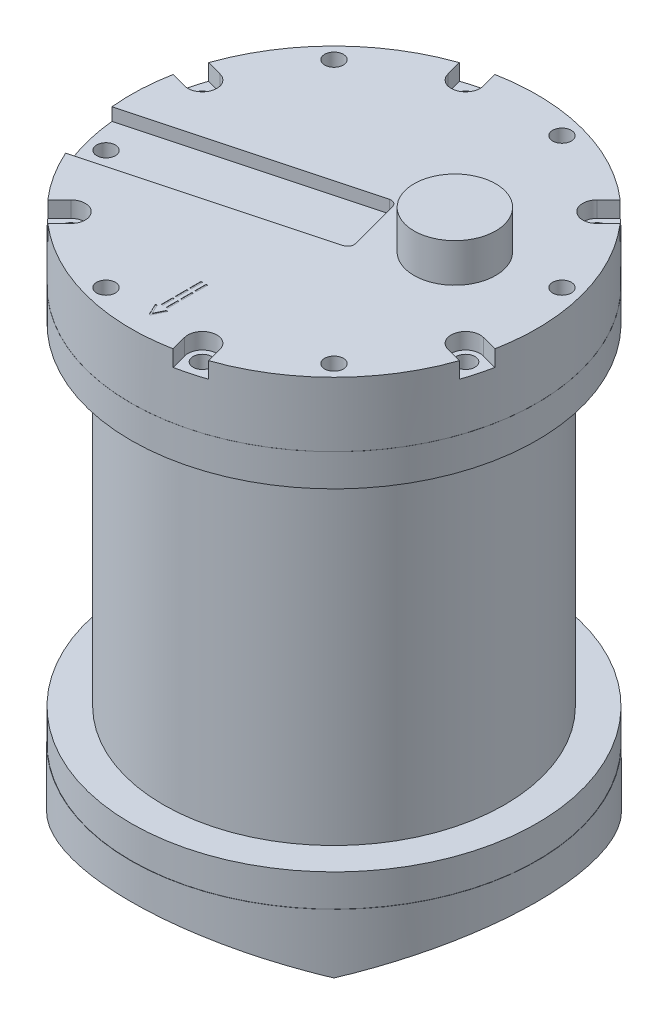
SolidWorks part; units mm, degrees
ref_plane "Front" through (0, 0, 0) normal (0, 0, 1) x (1, 0, 0)
ref_plane "Top" through (0, 0, 0) normal (0, 1, 0) x (1, 0, 0)
ref_plane "Right" through (0, 0, 0) normal (1, 0, 0) x (0, 0, -1)
sketch "Sketch1" plane through (0, 0, 0) normal (0, 1, 0) x (1, 0, 0)
  circle A0 centre (0, 0) radius 63.1
  dimension "D1" = 126.2
extrude "Extrude1" add sketch "Sketch1" along normal blind 31
sketch "Sketch2" plane through (0, 31, 0) normal (0, 1, 0) x (1, 0, 0)
  circle A0 centre (0, 0) radius 63.025
  dimension "D1" = 126.05
extrude "Extrude2" add sketch "Sketch2" along normal blind 10
sketch "Sketch3" plane through (0, 41, 0) normal (0, 1, 0) x (1, 0, 0)
  circle A0 centre (0, 0) radius 53
  dimension "D1" = 106
extrude "Extrude3" add sketch "Sketch3" along normal blind 103
sketch "Sketch4" plane through (0, 0, 0) normal (1, 0, 0) x (0, 0, -1)
  line L0 (4.1912, -3.8007) -> (63.1, 20)
  line L1 (63.1, 31) -> (-63.1, 31) construction
  line L2 (63.1, 0) -> (63.1, 31) construction
  line L4 (0, 31) -> (0, 0) construction
  line L5 (4.1912, -3.8007) -> (72.7161, -3.8007)
  line L6 (72.7161, -3.8007) -> (63.1, 20)
  dimension "D1" = 11
  dimension "D2" = 68
  dimension "D3" = 22
extrude "X-ducer Face" cut sketch "Sketch4" against normal through all and the other way through all
sketch "Sketch18" plane through (0, -4.7231, -1.9082) normal (0, -0.9272, -0.3746) x (1, 0, 0)
  circle A0 centre (0, -38) radius 23.5332
  dimension "D1" = 38
pattern_circular "CirPattern1" count 4 over 360 about axis through (0, 0, 0) along (0, 1, 0)
sketch "Sketch5" plane through (0, 144, 0) normal (0, 1, 0) x (1, 0, 0)
  circle A0 centre (0, 0) radius 63.025
  dimension "D1" = 126.05
extrude "Extrude5" add sketch "Sketch5" along normal blind 10
sketch "Sketch6" plane through (0, 154, 0) normal (0, 1, 0) x (1, 0, 0)
  circle A0 centre (0, 0) radius 63
  dimension "D1" = 126
extrude "Extrude6" add sketch "Sketch6" along normal blind 20
hole_wizard "Ø5.8 (5.8) Diameter Hole1" positions "Sketch9" profile "Sketch8" hole size "Ø5.8" standard "Ansi Metric"
sketch "Sketch9" plane through (0, 174, 0) normal (0, 1, 0) x (-1, 0, 0)
  line L0 (0, 0) -> (0, 88.6387) construction
  line L1 (0, 0) -> (55.8305, 14.9597) construction
  circle A0 centre (0, 0) radius 57.8 construction
  point P0 (55.8305, 14.9597)
  dimension "D1" = 115.6
  dimension "D2" = 75
sketch "Sketch8" plane through (-55.8305, 174, 14.9597) normal (1, 0, 0) x (0, 0, 1)
  line L0 (0, 0) -> (0, 30)
  line L1 (0, 30) -> (2.9, 30)
  line L2 (2.9, 30) -> (2.9, 0)
  line L5 (2.9, 0) -> (0, 0)
  line L11 (0, -6.35) -> (0, 107.95) construction
  dimension "Thru Hole Dia." = 5.8
  dimension "Thru Hole Depth" = 30
pattern_circular "CirPattern2" count 12 over 360 about axis through (0, 0, 0) along (0, 1, 0) of "Ø5.8 (5.8) Diameter Hole1"
sketch "Sketch15" plane through (0, 174, 0) normal (0, 1, 0) x (1, 0, 0)
  line L0 (0, 0) -> (-55.8305, 14.9597) construction
  line L1 (-54.6658, 19.3064) -> (-72.7565, 24.1538)
  line L2 (-56.9952, 10.6131) -> (-66.3926, 13.1311)
  line L3 (-1.1647, -4.3467) -> (-56.9952, 10.6131) construction
  line L4 (1.1647, 4.3467) -> (-54.6658, 19.3064) construction
  line L5 (-72.7565, 24.1538) -> (-66.3926, 13.1311)
  arc A0 (-56.9952, 10.6131) -> (-54.6658, 19.3064) centre (-55.8305, 14.9597) ccw
  dimension "D1" = 4.5
extrude "Extrude8" cut sketch "Sketch15" against normal blind 5
pattern_circular "CirPattern4" count 6 over 360 about axis through (0, 0, 0) along (0, 1, 0) of "Extrude8"
sketch "Sketch17" plane through (0, 174, 0) normal (0, 1, 0) x (1, 0, 0)
  line L0 (0, 0) -> (0, -70.1799) construction
  line L1 (0, 0) -> (-74.8738, -20.0624) construction
  line L2 (5.2524, 11.9258) -> (-77.5034, -10.2486)
  line L3 (10.5116, -7.7018) -> (-72.2442, -29.8762)
  line L4 (11.9258, -5.2524) -> (7.7018, 10.5116)
  line L5 (2.6296, -9.8138) -> (-72.2442, -29.8762) construction
  line L6 (-2.6296, 9.8138) -> (-77.5034, -10.2486) construction
  line L7 (-77.5034, -10.2486) -> (-72.2442, -29.8762)
  arc A0 (10.5116, -7.7018) -> (11.9258, -5.2524) centre (9.9939, -5.77) ccw
  arc A1 (5.2524, 11.9258) -> (7.7018, 10.5116) centre (5.77, 9.9939) cw
  dimension "D5" = 2
  dimension "D1" = 75
  dimension "D4" = 10.16
  dimension "D2" = 10.16
  dimension "D3" = 10.16
extrude "Extrude9" cut sketch "Sketch17" against normal blind 3.94
sketch "Sketch12" plane through (-2.0522, -5.4359, -0.144) normal (0, -0.9272, -0.3746) x (1, 0, 0)
  line L0 (10.7939, -37.9152) -> (-7.3991, -37.9152) construction
  text T0 "    3" font "Century Gothic" height in points 20
sketch "Sketch14" plane through (0, 174, 0) normal (0, 1, 0) x (1, 0, 0)
  line L0 (-3.5, -20.6688) -> (-3.5, -60.383) construction
  text T0 "         ===>" font "Century Gothic" height in points 20
  dimension "D1" = 3.5
extrude "Extrude7" cut sketch "Sketch14" against normal blind 0.1
sketch "Sketch16" plane through (0, 174, 0) normal (0, 1, 0) x (1, 0, 0)
  line L0 (0, 0) -> (29.599, 7.931) construction
  line L1 (0, 0) -> (0, 93.8349) construction
  circle A0 centre (29.599, 7.931) radius 12.6827
  circle A1 centre (0, 0) radius 30.6431 construction
  dimension "D2" = 25.3654
  dimension "D1" = 75
extrude "Zinc Anode" add sketch "Sketch16" along normal blind 12
sketch "Sketch19" plane through (0, -4.7231, -1.9082) normal (0, -0.9272, -0.3746) x (1, 0, 0)
  circle A1 centre (0, -38) radius 23.5332
  circle A2 centre (0, -38) radius 23.5332
  dimension "D1" = 0
extrude "Aft Beam" [suppressed] add sketch "Sketch19" along normal blind 85
sketch "Sketch20" [suppressed] plane through (0, -4.7231, 1.9082) normal (0, -0.9272, 0.3746) x (1, 0, 0)
  circle A1 centre (0, 38) radius 23.5332
  circle A2 centre (0, 38) radius 23.5332
  dimension "D1" = 0
extrude "Boss-Extrude1" [suppressed] add sketch "Sketch20" along normal blind 85
